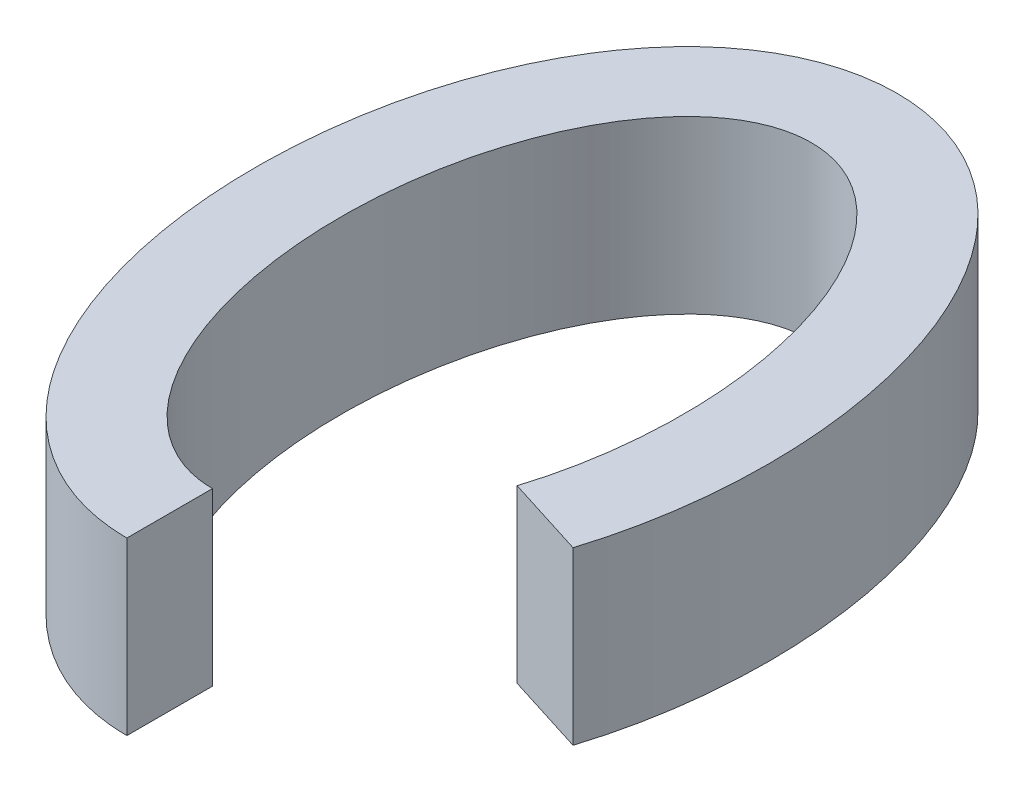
SolidWorks part; units mm, degrees
ref_plane "Front" through (0, 0, 0) normal (0, 0, 1) x (1, 0, 0)
ref_plane "Top" through (0, 0, 0) normal (0, 1, 0) x (1, 0, 0)
ref_plane "Right" through (0, 0, 0) normal (1, 0, 0) x (0, 0, -1)
sketch "Sketch1" plane through (0, 0, 0) normal (0, 1, 0) x (1, 0, 0)
  line L0 (0, 0) -> (0, -35) construction
  line L1 (0, 0) -> (17.5108, -16.91) construction
  line L2 (0, 0) -> (20, 0) construction
  ellipse E0 centre (0, 0) end of major axis (0, 35) minor radius 20 (17.5108, -16.91) -> (0, -35) ccw
  dimension "D1" = 40
  dimension "D2" = 70
  dimension "D3" = 44
extrude "Extrude-Thin1" add sketch "Sketch1" along normal blind 20 thin
